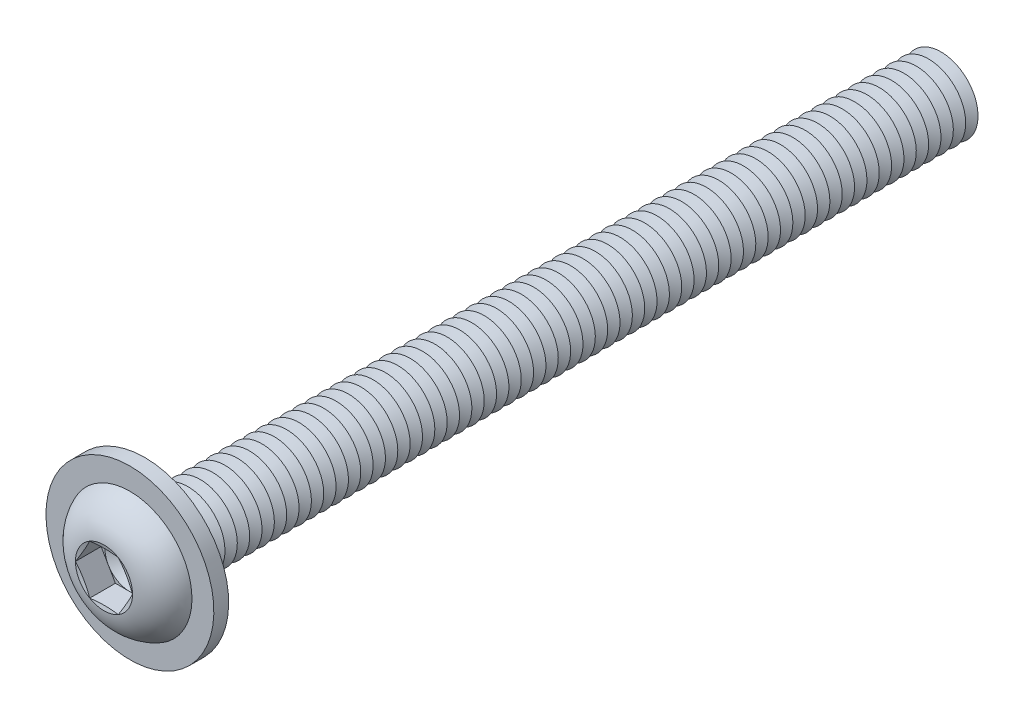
SolidWorks part; units mm, degrees
ref_plane "Front Plane" through (0, 0, 0) normal (0, 0, 1) x (1, 0, 0)
ref_plane "Top Plane" through (0, 0, 0) normal (0, 1, 0) x (1, 0, 0)
ref_plane "Right Plane" through (0, 0, 0) normal (1, 0, 0) x (0, 0, -1)
sketch "Sketch1" plane through (0, 0, 0) normal (1, 0, 0) x (0, 0, -1)
  line L0 (0, 3) -> (0, 5.25)
  line L3 (0, 3) -> (65, 3)
  line L4 (65, 3) -> (65, 0)
  line L5 (65, 0) -> (-3.3, 0) construction
  line L6 (-3.3, 0) -> (65, 0)
  line L7 (-3.3, 2.3094) -> (-3.3, 1.1547) construction
  line L8 (-3.3, 1.1547) -> (-3.3, 0)
  line L9 (-3.3, 2.3094) -> (-2.9906, 1.1547)
  line L10 (-2.9906, 1.1547) -> (-3.3, 1.1547)
  line L11 (65, 0) -> (22.7481, 0) construction
  line L12 (0, 5.25) -> (-3.3, 5.25) construction
  arc A1 (0, 5.25) -> (-3.3, 2.3094) centre (0, 1.928) ccw
  point P8 (65, 1.5)
  dimension "D1" = 10.5
  dimension "D2" = 6
  dimension "D3" = 3.3
  dimension "D4" = 4.6188
  dimension "D5" = 65
  dimension "D6" = 15
revolve "Revolve1" add sketch "Sketch1" angle 360 about L5
fillet "Fillet1" radius 0.5 1 edges at (0, 3, 0)
sketch "Sketch2" plane through (0, 0, 0) normal (1, 0, 0) x (0, 0, -1)
  line L0 (64.5, 3) -> (65.5, 3)
  line L1 (65, 3) -> (0.5, 3) construction
  line L2 (65.5, 3) -> (65, 2.134)
  line L3 (65, -3) -> (65, 3) construction
  line L4 (65, 2.134) -> (64.5, 3)
  dimension "D1" = 1
revolve "Cut-Revolve1" cut sketch "Sketch2" angle 360 about axis through (0, 0, -65) along (0, 0, -1)
pattern_linear "LPattern1" count 65 spacing 1 along (0, 0, 1) of "Cut-Revolve1"
sketch "Sketch3" plane through (0, 0, 3.3) normal (0, 0, 1) x (1, 0, 0)
  line L7 (1.1547, 2) -> (-1.1547, 2)
  line L8 (-1.1547, 2) -> (-2.3094, 0)
  line L9 (-2.3094, 0) -> (-1.1547, -2)
  line L10 (-1.1547, -2) -> (1.1547, -2)
  line L11 (1.1547, -2) -> (2.3094, 0)
  line L12 (2.3094, 0) -> (1.1547, 2)
  circle A0 centre (0, 0) radius 2 construction
  circle A3 centre (0, 0) radius 2.3094 construction
extrude "Cut-Extrude1" cut sketch "Sketch3" against normal blind 2.08
sketch "Sketch4" plane through (0, 0, 1.22) normal (0, 0, 1) x (1, 0, 0)
  line L1 (1.1547, 2) -> (-1.1547, 2) construction
  circle A0 centre (0, 0) radius 2
extrude "Cut-Extrude2" cut sketch "Sketch4" against normal through all draft 60
sketch "Sketch5" plane through (0, 0, 0) normal (0, 0, -1) x (-1, 0, 0)
  circle A0 centre (0, 0) radius 6.8
  circle A1 centre (0, 0) radius 3.5
  circle A2 centre (0, 0) radius 3.5 construction
  dimension "D1" = 13.6
extrude "Boss-Extrude1" add sketch "Sketch5" against normal blind 1.2
